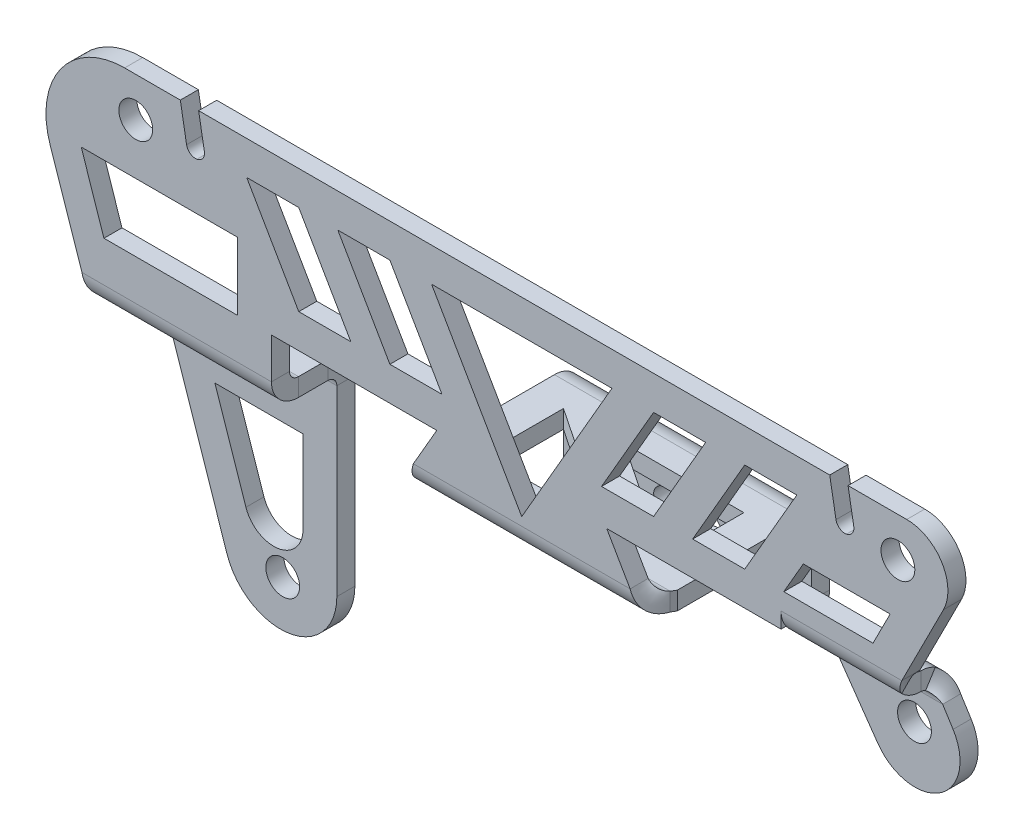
SolidWorks part; units mm, degrees
ref_plane "Plan de face" through (0, 0, 0) normal (0, 0, 1) x (1, 0, 0)
ref_plane "Plan de dessus" through (0, 0, 0) normal (0, 1, 0) x (1, 0, 0)
ref_plane "Plan de droite" through (0, 0, 0) normal (1, 0, 0) x (0, 0, -1)
mirrored part "carter bas_Symétrique"
other "<carter bas>-<Extrusion5>"
